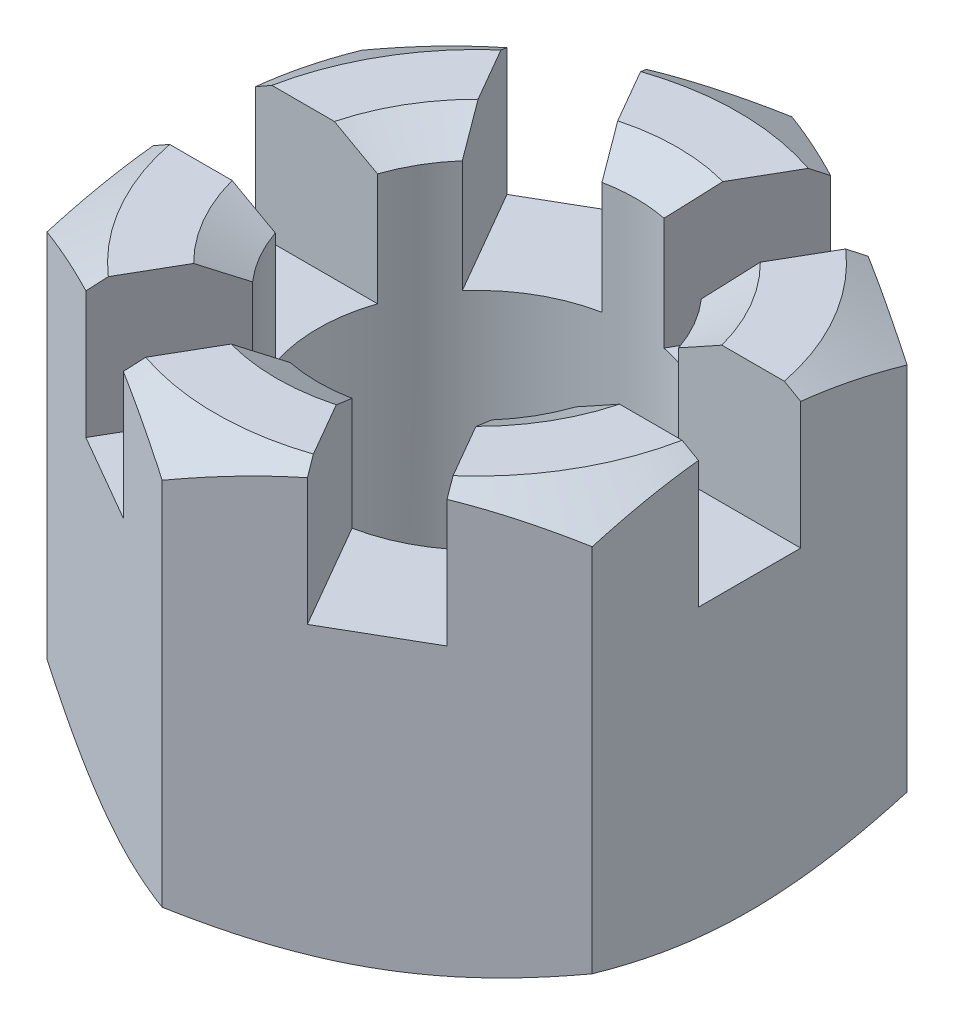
SolidWorks part; units mm, degrees
ref_plane "Front Plane" through (0, 0, 0) normal (0, 0, 1) x (1, 0, 0)
ref_plane "Top Plane" through (0, 0, 0) normal (0, 1, 0) x (1, 0, 0)
ref_plane "Right Plane" through (0, 0, 0) normal (1, 0, 0) x (0, 0, -1)
sketch "BaseNutSke" plane through (0, 0, 0) normal (0, 1, 0) x (1, 0, 0)
  line L1 (0, 13.8564) -> (-12, 6.9282)
  line L2 (-12, 6.9282) -> (-12, -6.9282)
  line L3 (-12, -6.9282) -> (0, -13.8564)
  line L4 (0, -13.8564) -> (12, -6.9282)
  line L5 (12, -6.9282) -> (12, 6.9282)
  line L6 (12, 6.9282) -> (0, 13.8564)
  circle A0 centre (0, 0) radius 12 construction
  dimension "Width" = 24
extrude "BaseNut" add sketch "BaseNutSke" along normal blind 19
ref_plane "MidPlane" through (0, 9.5, 0) normal (0, 1, 0) x (-1, 0, 0)
sketch "CutNutSke" plane through (0, 0, 0) normal (1, 0, 0) x (0, 0, -1)
  line L0 (-13.8564, 19) -> (-11.5, 19)
  line L1 (-11.5, 19) -> (-13.8564, 17.6395)
  line L2 (-13.8564, 17.6395) -> (-13.8564, 19)
  line L3 (0, 0) -> (0, 8.4136) construction
  dimension "Chamf_ang" = 30
  dimension "Chamfer_diameter" = 23
revolve "CutNut" cut sketch "CutNutSke" angle 360 about L3
mirror "MirrorChamfer" about plane through (0, 9.5, 0) normal (0, 1, 0) of "CutNut"
sketch "HoleSke" plane through (0, 0, 0) normal (0, 1, 0) x (1, 0, 0)
  circle A0 centre (0, 0) radius 7
  dimension "Tap_drill" = 14
extrude "TappedHole" cut sketch "HoleSke" along normal through all
chamfer "Chamfer1" distance 1.05 angle 60 2 edges at (0, 19, 7) (0, 0, 7)
sketch "SlotSke" plane through (0, 0, 0) normal (1, 0, 0) x (0, 0, -1)
  line L0 (0, 0) -> (0, 7.747) construction
  line L2 (-2.25, 32) -> (2.25, 32)
  line L3 (-2.25, 32) -> (-2.25, 13)
  line L4 (-2.25, 13) -> (2.25, 13)
  line L5 (2.25, 32) -> (2.25, 13)
  dimension "D1" = 19
  dimension "Slot_height" = 13
  dimension "Slot_width" = 4.5
extrude "Slot" cut sketch "SlotSke" against normal blind 28.8
pattern_circular "SlotPat" count 6 over 360 about axis through (0, 0, 0) along (0, 1, 0) of "Slot"
sketch "ThdSchSke" plane through (0, 0, 0) normal (0, 0, 1) x (1, 0, 0)
  line L0 (-8, 1.6274) -> (-7, 1.05)
  line L1 (-7, 1.05) -> (-5.8453, 1.05)
  line L2 (-5.8453, 1.05) -> (-5.8453, 2.2047)
  line L3 (-5.8453, 2.2047) -> (-7, 2.2047)
  line L4 (-7, 2.2047) -> (-8, 1.6274)
  line L5 (0, -3.4988) -> (0, 3.4988) construction
  line L8 (7, 1.05) -> (-7, 1.05) construction
  line L9 (7, 1.05) -> (-7, 1.05) construction
  dimension "ThreadN" = 16
  dimension "Tap_drill" = 14
revolve "ThreadSchematic" [suppressed] cut sketch "ThdSchSke" angle 360 about L5
pattern_linear "ThdSchPat" [suppressed]
equation "\"D1@Chamfer1\" = \"Tap_drill@HoleSke\"*0.075"
equation "\"D1@SlotSke\" = \"Height@BaseNut\""
equation "\"D1@Slot\" = \"Width@BaseNutSke\"*1.2"
equation "\"Tap_drill@ThdSchSke\" = \"Tap_drill@HoleSke\""
equation "\"ThreadN@ThdSchSke\" = \"Thread_major@ThreadCosmetic\""
equation "\"Num_threads@ThdSchPat\" =  int(( \"Height@BaseNut\" - \"D1@Chamfer1\" *2) /\"Advance@ThdSchPat\" ) "
